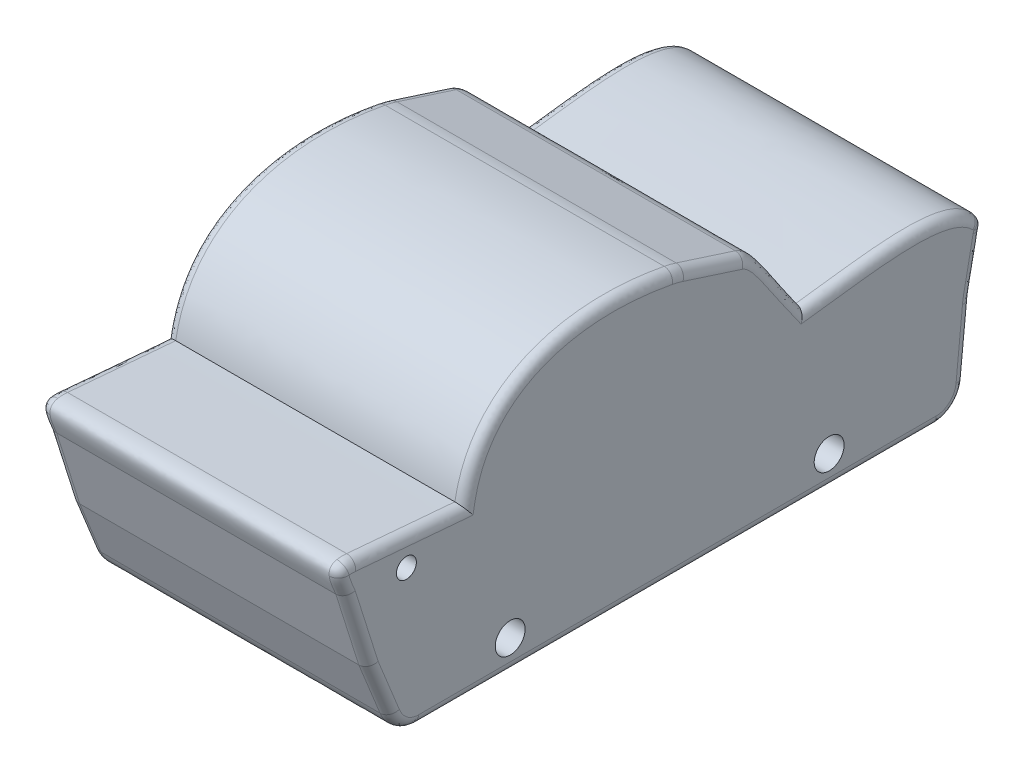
SolidWorks part; units mm, degrees
ref_plane "Front Plane" through (0, 0, 0) normal (0, 0, 1) x (1, 0, 0)
ref_plane "Top Plane" through (0, 0, 0) normal (0, 1, 0) x (1, 0, 0)
ref_plane "Right Plane" through (0, 0, 0) normal (1, 0, 0) x (0, 0, -1)
sketch "Sketch7" plane through (0, 0, 0) normal (1, 0, 0) x (0, 0, -1)
  line L0 (-36.3821, 13.17) -> (-32.4345, 4.519)
  line L1 (-32.4345, 4.519) -> (-30.9473, 1.2597)
  line L2 (-28.9877, 0) -> (28.9877, 0)
  line L3 (31.1233, 1.8734) -> (32.1301, 9.5404)
  circle A0 centre (-18.1202, 4.8462) radius 1.5
  circle A1 centre (16.3413, 4.8462) radius 1.5
  ellipse E0 centre (16.3413, 4.8462) end of major axis (14.8413, 4.8462) minor radius 1.5 construction
  ellipse E1 centre (-18.1202, 4.8462) end of major axis (-19.6203, 4.8462) minor radius 1.5 construction
  spline S0 degree 3 poles (13.4058, 14.0332) (9.7428, 18.8103) (7.7757, 21.3193) (5.6198, 21.9921) knots 0 0 0 0 0.083333 0.083333 0.083333 0.083333
  spline S1 degree 3 poles (5.6198, 21.9921) (-7.8403, 26.1918) (-21.0242, 24.526) (-23.025, 14.0332) knots 0.083333 0.083333 0.083333 0.083333 0.166667 0.166667 0.166667 0.166667
  spline S2 degree 3 poles (-23.025, 14.0332) (-24.7066, 14.1529) (-31.3376, 14.6887) (-34.7122, 14.9701) knots 0.166667 0.166667 0.166667 0.166667 0.25 0.25 0.25 0.25
  spline S3 degree 3 poles (-34.7122, 14.9701) (-37.4815, 15.2011) (-37.0956, 14.7328) (-36.3821, 13.17) knots 0.25 0.25 0.25 0.25 0.333333 0.333333 0.333333 0.333333
  spline S4 degree 3 poles (-30.9473, 1.2597) (-30.589, 0.4745) (-29.8508, 0) (-28.9877, 0) knots 0.5 0.5 0.5 0.5 0.583333 0.583333 0.583333 0.583333
  spline S5 degree 3 poles (28.9877, 0) (30.0755, 0) (30.9817, 0.795) (31.1233, 1.8734) knots 0.666667 0.666667 0.666667 0.666667 0.75 0.75 0.75 0.75
  spline S6 degree 3 poles (32.1301, 9.5404) (32.1869, 9.9732) (33.2508, 12.6709) (33.0816, 12.8881) knots 0.833333 0.833333 0.833333 0.833333 0.916667 0.916667 0.916667 0.916667
  spline S7 degree 3 poles (33.0816, 12.8881) (30.1465, 16.6593) (21.1661, 14.8819) (13.4058, 14.0332) knots 0.916667 0.916667 0.916667 0.916667 1 1 1 1
extrude "Boss-Extrude6" add sketch "Sketch7" along normal mid plane 30
delete or keep bodies "Body-Delete/Keep 1" type delete bodies bodies 139
sketch "Sketch8" plane through (0, 0, 0) normal (1, 0, 0) x (0, 0, -1)
  line L0 (1.987, 28.088) -> (7.929, 26.1742)
  line L1 (30.7168, 11.0385) -> (30.067, 4.5001)
  line L2 (27.0773, 1.748) -> (-24.8574, 1.748)
  line L3 (-27.7101, 3.8194) -> (-29.8458, 9.0801)
  line L4 (-29.8458, 9.0801) -> (-32.1488, 16.3792)
  circle A0 centre (16.3413, 4.8462) radius 1.5
  circle A1 centre (-15.6587, 4.8462) radius 1.5
  ellipse E0 centre (-26.0703, 16.1244) end of major axis (-26.0703, 17.1244) minor radius 1
  ellipse E1 centre (16.3413, 4.8462) end of major axis (14.8413, 4.8462) minor radius 1.5 construction
  ellipse E2 centre (-15.6587, 4.8462) end of major axis (-17.1587, 4.8462) minor radius 1.5 construction
  spline S0 degree 3 poles (-20.2132, 18.4325) (-18.6828, 27.0084) (-10.4023, 30.5304) (0.7966, 28.3923) knots 0 0 0 0 0.066667 0.066667 0.066667 0.066667
  spline S1 degree 3 poles (0.7966, 28.3923) (1.2199, 28.3116) (1.5768, 28.2202) (1.987, 28.088) knots 0.066667 0.066667 0.066667 0.066667 0.133333 0.133333 0.133333 0.133333
  spline S2 degree 3 poles (7.929, 26.1742) (9.4288, 25.691) (10.588, 23.308) (13.9893, 18.568) knots 0.2 0.2 0.2 0.2 0.266667 0.266667 0.266667 0.266667
  spline S3 degree 3 poles (13.9893, 18.568) (20.8675, 19.3718) (28.4374, 20.8915) (31.4819, 17.7741) knots 0.266667 0.266667 0.266667 0.266667 0.330301 0.330301 0.330301 0.330301
  spline S4 degree 3 poles (31.7553, 16.4962) (31.4302, 14.5746) (30.7292, 11.6616) (30.7168, 11.0385) knots 0.354521 0.354521 0.354521 0.354521 0.4 0.4 0.4 0.4
  spline S6 degree 3 poles (30.067, 4.5001) (29.9122, 2.9428) (28.6427, 1.748) (27.0773, 1.748) knots 0.533333 0.533333 0.533333 0.533333 0.6 0.6 0.6 0.6
  spline S7 degree 3 poles (-24.8574, 1.748) (-26.1787, 1.748) (-27.2147, 2.5991) (-27.7101, 3.8194) knots 0.666667 0.666667 0.666667 0.666667 0.733333 0.733333 0.733333 0.733333
  spline S8 degree 3 poles (-32.1488, 16.3792) (-32.8114, 17.9297) (-33.6369, 19.5911) (-31.0656, 19.3621) knots 0.866667 0.866667 0.866667 0.866667 0.933333 0.933333 0.933333 0.933333
  spline S9 degree 3 poles (-31.0656, 19.3621) (-27.9322, 19.083) (-21.7747, 18.5513) (-20.2132, 18.4325) knots 0.933333 0.933333 0.933333 0.933333 1 1 1 1
  spline S10 degree 3 poles (31.4819, 17.7741) (31.689, 17.5621) (31.9296, 17.1446) (31.8656, 16.858) (31.7553, 16.4962) knots 0 0 0 0 0.484361 1 1 1 1
  point P26 (0, 0)
  point P37 (0, 0)
  point P38 (31.8506, 17.1884)
  point P40 (0, 0)
  point P41 (0, 0)
  point P42 (0, 0)
  point P43 (0, 0)
  point P44 (0, 0)
extrude "Boss-Extrude7" add sketch "Sketch8" along normal mid plane 30 separate body
sketch "Sketch10" plane through (15, 0, 0) normal (1, 0, 0) x (0, 0, -1)
  circle A0 centre (-26.0703, 16.1244) radius 1 construction
  circle A1 centre (-26.0703, 16.1244) radius 1
extrude "Cut-Extrude1" cut sketch "Sketch10" against normal blind 6
fillet "Fillet5" radius 1 13 edges at (15, 27.1311, -4.958) (15, 7.7693, -30.3919) (15, 1.748, -1.1099) (15, 6.4498, 28.778) (15, 12.7297, 30.9973)
fillet "Fillet6" radius 1 13 edges at (-15, 12.7297, 30.9973) (-15, 6.4498, 28.778) (-15, 1.748, -1.1099) (-15, 7.7693, -30.3919) (-15, 27.1311, -4.958)
